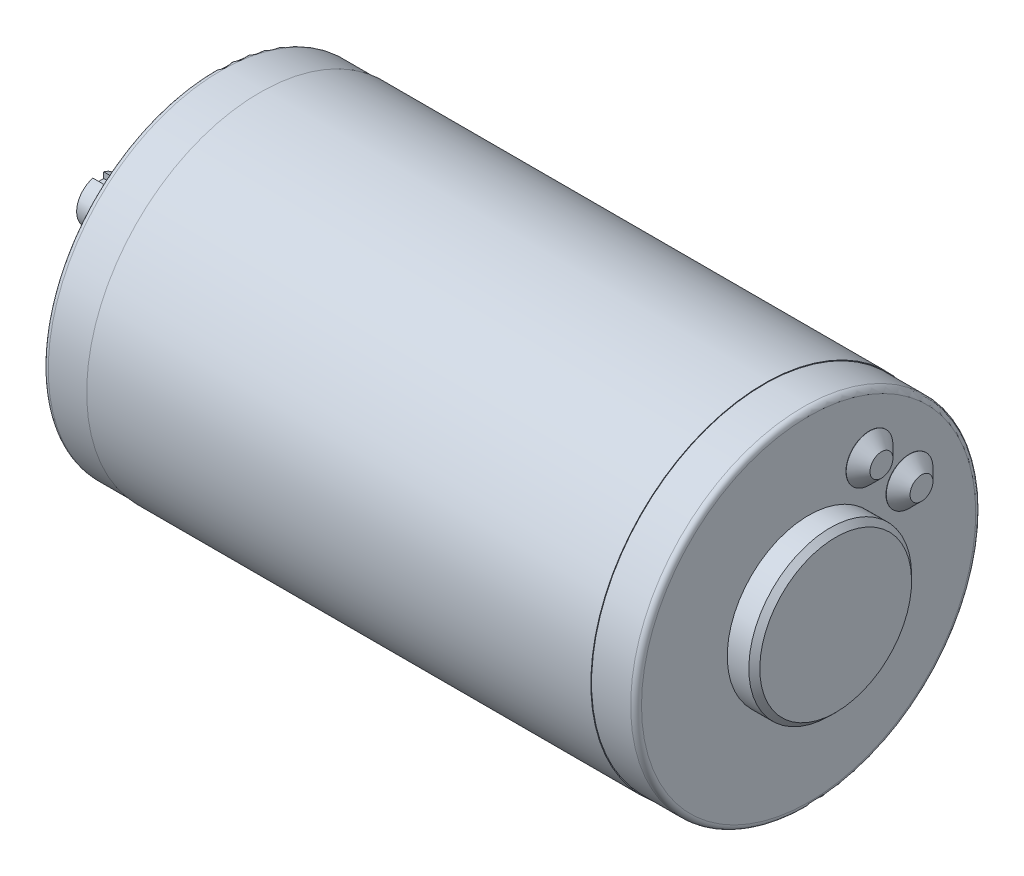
SolidWorks part; units mm, degrees
other "Chamfer3"
ref_plane "Front Plane" through (0, 0, 0) normal (0, 0, 1) x (1, 0, 0)
ref_plane "Top Plane" through (0, 0, 0) normal (0, 1, 0) x (1, 0, 0)
ref_plane "Right Plane" through (0, 0, 0) normal (1, 0, 0) x (0, 0, -1)
imported_body "Imported1"
sketch "Sketch1" plane through (-35.6, 0, 0) normal (-1, 0, 0) x (0, 0, 1)
  circle A0 centre (0, 0) radius 54.2286
extrude "Cut-Extrude1" cut sketch "Sketch1" against normal blind 13.97
